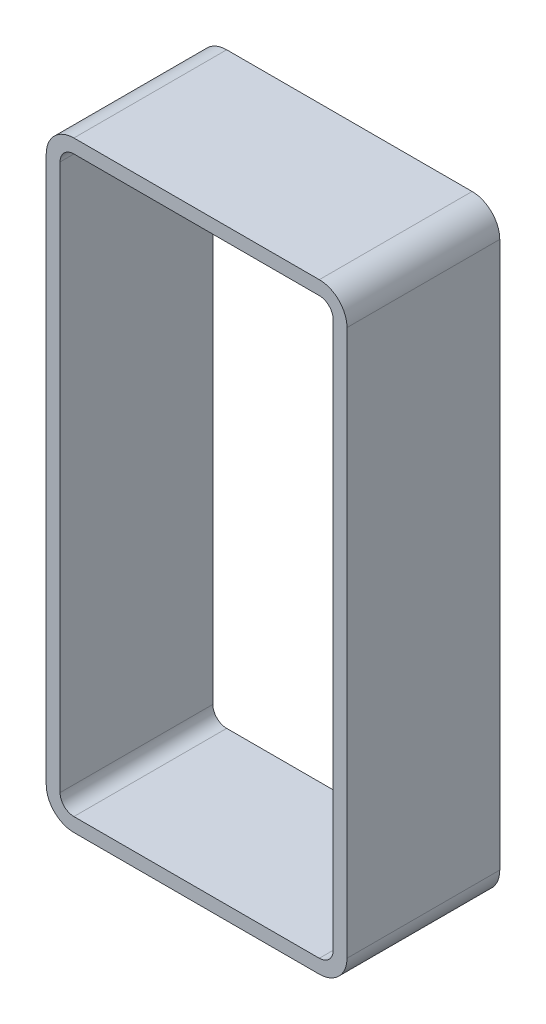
SolidWorks part; units mm, degrees
ref_plane "Front Plane" through (0, 0, 0) normal (0, 0, 1) x (1, 0, 0)
ref_plane "Top Plane" through (0, 0, 0) normal (0, 1, 0) x (1, 0, 0)
ref_plane "Right Plane" through (0, 0, 0) normal (1, 0, 0) x (0, 0, -1)
sketch "Sketch1" plane through (0, 0, 0) normal (0, 0, 1) x (1, 0, 0)
  line L0 (-20.4, 47.7) -> (20.4, 47.7)
  line L1 (-20.4, -50) -> (20.4, -50)
  line L2 (-25, -45.4) -> (-25, 45.4)
  line L3 (-20.4, 50) -> (20.4, 50)
  line L4 (25, -45.4) -> (25, 45.4)
  line L5 (-25, -50) -> (25, 50) construction
  line L6 (-25, 50) -> (25, -50) construction
  line L7 (22.7, -45.4) -> (22.7, 45.4)
  line L8 (-20.4, -47.7) -> (20.4, -47.7)
  line L9 (-22.7, -45.4) -> (-22.7, 45.4)
  arc A0 (-25, 45.4) -> (-20.4, 50) centre (-20.4, 45.4) cw
  arc A1 (20.4, 50) -> (25, 45.4) centre (20.4, 45.4) cw
  arc A2 (-20.4, -50) -> (-25, -45.4) centre (-20.4, -45.4) cw
  arc A3 (20.4, -50) -> (25, -45.4) centre (20.4, -45.4) ccw
  arc A4 (-22.7, 45.4) -> (-20.4, 47.7) centre (-20.4, 45.4) cw
  arc A5 (20.4, 47.7) -> (22.7, 45.4) centre (20.4, 45.4) cw
  arc A6 (20.4, -47.7) -> (22.7, -45.4) centre (20.4, -45.4) ccw
  arc A7 (-20.4, -47.7) -> (-22.7, -45.4) centre (-20.4, -45.4) cw
  point P0 (0, 0)
  dimension "D2" = 4.6
  dimension "Thickness" = 2.3
  dimension "Width" = 50
  dimension "Depth" = 100
extrude "BaseSection" add sketch "Sketch1" along normal mid plane 25.4
equation "\"D2@Sketch1\" = \"Thickness@Sketch1\" * (  (IIf(\"Thickness@Sketch1\">3, 1.5, 1))  + 1 ) "
